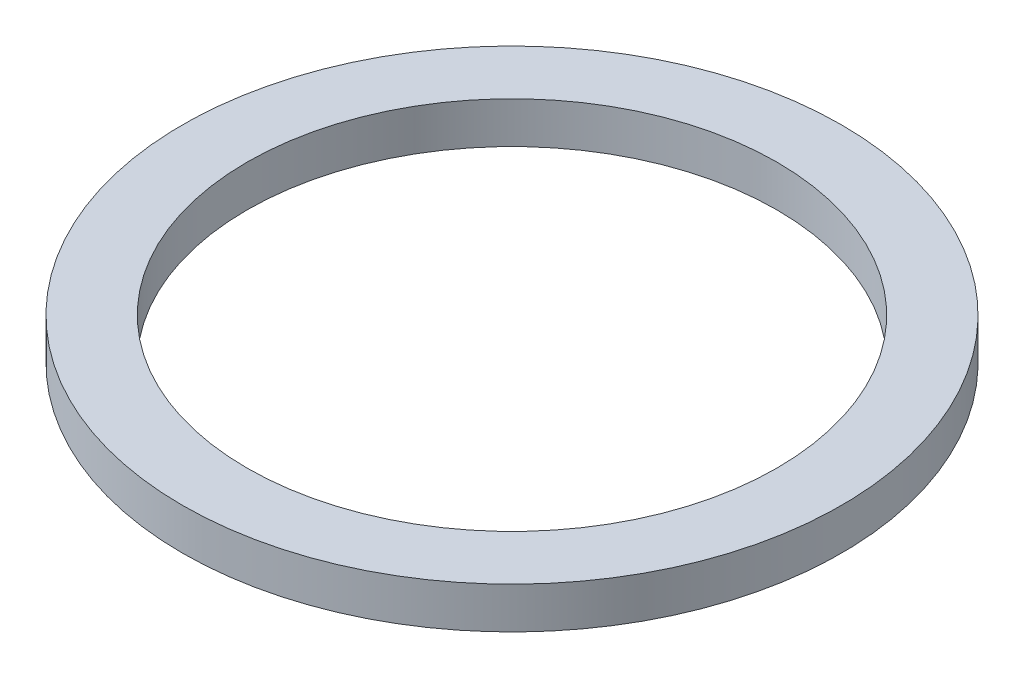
SolidWorks part; units mm, degrees
ref_plane "Front Plane" through (0, 0, 0) normal (0, 0, 1) x (1, 0, 0)
ref_plane "Top Plane" through (0, 0, 0) normal (0, 1, 0) x (1, 0, 0)
ref_plane "Right Plane" through (0, 0, 0) normal (1, 0, 0) x (0, 0, -1)
sketch "Sketch1" plane through (0, 0, 0) normal (0, 1, 0) x (1, 0, 0)
  circle A0 centre (0, 0) radius 12.6365
  circle A1 centre (0, 0) radius 10.16
  dimension "D1" = 25.273
  dimension "D2" = 20.32
extrude "Boss-Extrude1" add sketch "Sketch1" along normal blind 1.5875
